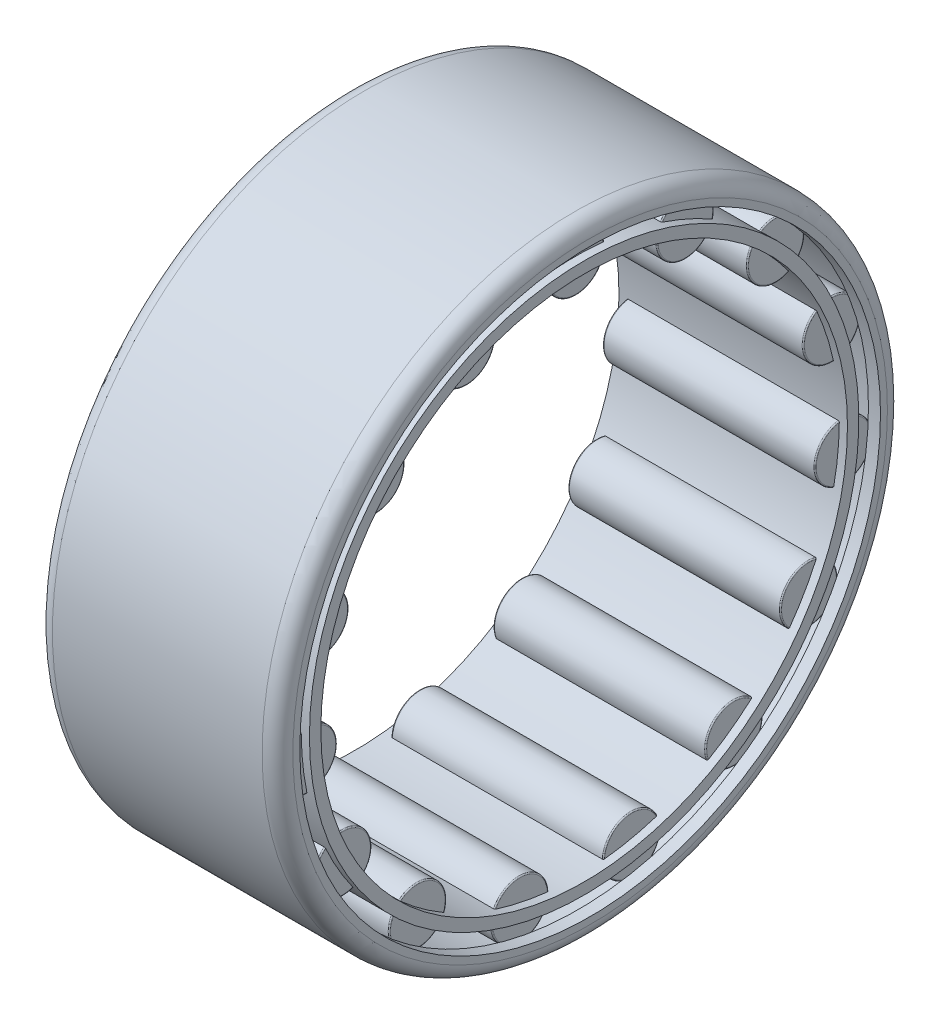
SolidWorks part; units mm, degrees
ref_plane "Plane1" through (0, 0, 0) normal (0, 0, 1) x (1, 0, 0)
ref_plane "Plane2" through (0, 0, 0) normal (0, 1, 0) x (1, 0, 0)
ref_plane "Plane3" through (0, 0, 0) normal (1, 0, 0) x (0, 0, -1)
sketch "Clipboard" plane through (0, 0, 0) normal (0, 0, 1) x (1, 0, 0)
  line L0 (-10, 0) -> (10, 0) construction
  line L1 (41.1529, 1.4371) -> (62.7517, -4.3503)
  line L2 (41.1529, 1.4371) -> (75.4583, 10.6292)
  line L3 (41.1529, 1.4371) -> (62.7517, -4.3503)
  line L4 (41.1529, 1.4371) -> (-22.3471, -0.7804)
  dimension "BallCLRad" = 35.5155
  dimension "Count" = 15
  dimension "Show_count" = 15
  dimension "Max_count" = 15
  dimension "Min_count" = 2
  dimension "Bore" = 63.5
sketch "InnRacSke" plane through (0, 0, 0) normal (0, 0, 1) x (1, 0, 0)
  line L0 (-14.2875, 38.3286) -> (-15.875, 38.3286)
  line L1 (-15.875, 38.3286) -> (-15.875, 39.243)
  line L2 (-13.843, 41.275) -> (13.843, 41.275)
  line L4 (15.875, 39.243) -> (15.875, 38.3286)
  line L5 (15.875, 38.3286) -> (14.2875, 38.3286)
  line L6 (14.2875, 38.3286) -> (14.2875, 39.2811)
  line L7 (14.2875, 39.2811) -> (-14.2875, 39.2811)
  line L8 (-14.2875, 39.2811) -> (-14.2875, 38.3286)
  line L9 (-31.75, 0) -> (31.75, 0) construction
  arc A0 (-15.875, 39.243) -> (-13.843, 41.275) centre (-13.843, 39.243) cw
  arc A2 (13.843, 41.275) -> (15.875, 39.243) centre (13.843, 39.243) cw
  dimension "radius" = 2.032
  dimension "D1" = 78.5622
  dimension "OD" = 82.55
  dimension "Width" = 31.75
  dimension "groove_dp" = 0.9525
  dimension "Cyl_Len" = 28.575
  dimension "halfCyl" = 14.2875
revolve "Race" add sketch "InnRacSke" angle 360 about L9
sketch "RolDetSke" plane through (0, 0, 0) normal (0, 0, 1) x (1, 0, 0)
  line L0 (-14.0018, 39.131) -> (-14.0017, 35.5155)
  line L1 (-14.0017, 35.5155) -> (14.0017, 35.5155)
  line L2 (14.0017, 35.5155) -> (14.0018, 39.131)
  line L3 (13.8511, 39.2816) -> (-13.8511, 39.2816)
  line L4 (-28.575, 35.5155) -> (28.575, 35.5155) construction
  arc A0 (14.0018, 39.131) -> (13.8511, 39.2816) centre (13.8511, 39.131) ccw
  arc A1 (-13.8511, 39.2816) -> (-14.0018, 39.131) centre (-13.8511, 39.131) ccw
  dimension "Roller_radius" = 0.1506
  dimension "Roller_diameter" = 7.5321
  dimension "Roller_length" = 28.0035
  dimension "RollerCLRad" = 35.5155
  dimension "halfLength" = 14.0017
revolve "RollerDetailed" add sketch "RolDetSke" angle 360 about L4
ref_axis "Axis1" through (-50, 0, 0) along (1, 0, 0)
sketch "CagSpiSke" plane through (0, 0, 0) normal (0, 0, 1) x (1, 0, 0)
  line L0 (15.0812, 34.7623) -> (15.0812, 36.2688)
  line L1 (15.0812, 36.2688) -> (-15.0813, 36.2688)
  line L2 (-15.0813, 36.2688) -> (-15.0813, 34.7623)
  line L3 (-15.0813, 34.7623) -> (15.0812, 34.7623)
  line L4 (-31.75, 0) -> (31.75, 0) construction
  dimension "Cage_width" = 30.1625
  dimension "D2" = 69.5247
  dimension "Cage_thickness" = 1.5064
  dimension "halfWidth" = 15.0813
revolve "CageSpine" add sketch "CagSpiSke" angle 360 about L4
pattern_circular "RollersDetailed" count 15 every 24 about axis through (-50, 0, 0) along (1, 0, 0) of "RollerDetailed"
sketch "RolSimSke" plane through (0, 0, 0) normal (0, 0, 1) x (1, 0, 0)
  line L0 (-25.4, 0) -> (25.4, 0) construction
  line L2 (-13.8511, 39.2821) -> (13.8511, 39.2821)
  line L3 (-14.0018, 39.1315) -> (-14.0018, 31.9006)
  line L4 (-13.8511, 31.75) -> (13.8511, 31.75)
  line L5 (14.0017, 39.1315) -> (14.0017, 31.9006)
  arc A0 (-14.0018, 31.9006) -> (-13.8511, 31.75) centre (-13.8511, 31.9006) ccw
  arc A1 (-13.8511, 39.2821) -> (-14.0018, 39.1315) centre (-13.8511, 39.1315) ccw
  arc A2 (14.0017, 39.1315) -> (13.8511, 39.2821) centre (13.8511, 39.1315) ccw
  arc A3 (13.8511, 31.75) -> (14.0017, 31.9006) centre (13.8511, 31.9006) ccw
  point P10 (-14.0018, 31.75)
  point P15 (14.0017, 39.2821)
  point P18 (14.0017, 31.75)
  dimension "D1" = 0.1506
  dimension "Bore" = 63.5
  dimension "Roller_length" = 28.0035
  dimension "Roller_diameter" = 7.5321
  dimension "halfWidth" = 14.0017
revolve "RollersSimplified" [suppressed] add sketch "RolSimSke" angle 360 about L0
equation "\"BallCLRad@Clipboard\" =  ( \"D1@InnRacSke\" + \"Bore@Clipboard\" )  / 4"
equation "\"RollerCLRad@RolDetSke\" = \"BallCLRad@Clipboard\""
equation "\"halfCyl@InnRacSke\" = \"Cyl_Len@InnRacSke\" / 2"
equation "\"Roller_diameter@RolDetSke\" =  ( \"D1@InnRacSke\" - \"Bore@Clipboard\" )  / 2 + .001"
equation "\"Roller_radius@RolDetSke\" = \"Roller_diameter@RolDetSke\" / 50"
equation "\"Roller_length@RolDetSke\" = \"Cyl_Len@InnRacSke\" * .98"
equation "\"halfLength@RolDetSke\" = \"Roller_length@RolDetSke\" / 2"
equation "\"Cage_width@CagSpiSke\" =  ( \"Cyl_Len@InnRacSke\" + \"Width@InnRacSke\" )  / 2"
equation "\"halfWidth@CagSpiSke\" = \"Cage_width@CagSpiSke\" / 2"
equation "\"Roller_length@RolSimSke\" = \"Cyl_Len@InnRacSke\" * .98"
equation "\"halfWidth@RolSimSke\" = \"Roller_length@RolSimSke\" / 2"
equation "\"D1@RolSimSke\" = \"Roller_radius@RolDetSke\""
equation "\"Roller_diameter@RolSimSke\" =  ( \"D1@InnRacSke\" - \"Bore@Clipboard\" )  / 2 + .001"
equation "\"Cage_thickness@CagSpiSke\"  = \"Roller_diameter@RolDetSke\" / 5"
equation "\"D2@CagSpiSke\" =  \"RollerCLRad@RolDetSke\" * 2 - \"Cage_thickness@CagSpiSke\""
equation "\"Max_count@Clipboard\" = int( 3.14159265 / atn(( \"Roller_diameter@RolDetSke\" / 2) / sqr( \"RollerCLRad@RolDetSke\"  *  \"RollerCLRad@RolDetSke\" - ( \"Roller_diameter@RolDetSke\" / 2) *  ( \"Roller_diameter@R"
equation "\"Max_count@Clipboard\" = ((sgn( \"Max_count@Clipboard\" - \"Count@Clipboard\" )-1)*( \"Max_count@Clipboard\" - \"Count@Clipboard\" ))/-2+ \"Count@Clipboard\""
equation "\"Count@RollersDetailed\" = int( \"Show_count@Clipboard\" ) "
equation "\"Count@RollersDetailed\" = ((sgn( \"Count@RollersDetailed\" - \"Max_count@Clipboard\" )-1)*( \"Count@RollersDetailed\" - \"Max_count@Clipboard\" ))/-2+ \"Max_count@Clipboard\""
equation "\"Count@RollersDetailed\" = ((sgn( \"Count@RollersDetailed\" - \"Min_count@Clipboard\" )+1)*( \"Count@RollersDetailed\" - \"Min_count@Clipboard\"))/2 +\"Min_count@Clipboard\""
equation "\"Angle@RollersDetailed\" = 360.0 / \"Max_count@Clipboard\""
equation "\"Angle@CageSpine\" =  \"Angle@RollersDetailed\" * ( \"Count@RollersDetailed\" -1 + int( \"Count@RollersDetailed\" / \"Max_count@Clipboard\" ) )  + 0.001 -  int( \"Count@RollersDetailed\" / \"Max_count@Clipboard\" "
equation "\"Angle@CageSpine\" =  \"Angle@CageSpine\" * int( \"Min_count@Clipboard\" / 2) + int(1 / \"Min_count@Clipboard\")  * 0.001"
equation "\"Bore@RolSimSke\" = \"Bore@Clipboard\""
